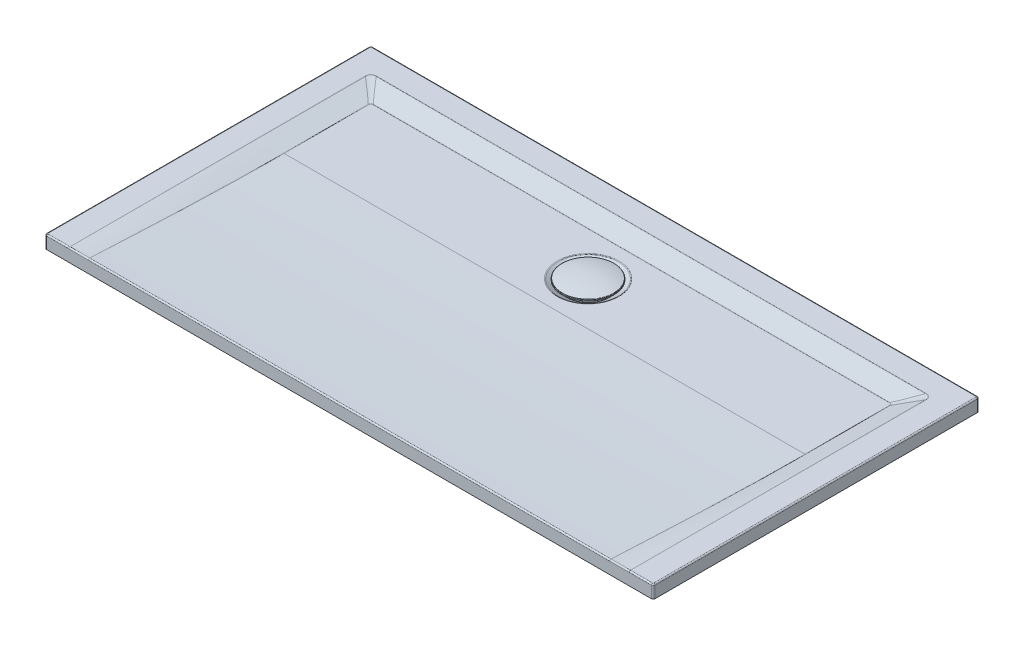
SolidWorks part; units mm, degrees
ref_plane "Płaszczyzna przednia" through (0, 0, 0) normal (0, 0, 1) x (1, 0, 0)
ref_plane "Płaszczyzna górna" through (0, 0, 0) normal (0, 1, 0) x (1, 0, 0)
ref_plane "Płaszczyzna prawa" through (0, 0, 0) normal (1, 0, 0) x (0, 0, -1)
sketch "Szkic1" plane through (0, 0, 0) normal (0, 1, 0) x (1, 0, 0)
  line L0 (0, 375) -> (0, -375) construction
  line L1 (-700, 375) -> (700, 375)
  line L2 (-700, 375) -> (-700, -375)
  line L3 (-700, -375) -> (700, -375)
  line L4 (700, 375) -> (700, -375)
  line L5 (-645, -375) -> (-645, 320)
  line L6 (-645, 320) -> (645, 320)
  line L7 (645, 320) -> (645, -375)
  line L8 (-600, -375) -> (-600, 275)
  line L9 (-600, 275) -> (600, 275)
  line L10 (600, 275) -> (600, -375)
  circle A0 centre (0, 175) radius 45
  circle A1 centre (0, 175) radius 70
  point P9 (0, 320)
  dimension "D6" = 90
  dimension "D7" = 140
  dimension "D1" = 1400
  dimension "D2" = 55
  dimension "D3" = 55
  dimension "D5" = 200
  dimension "D8" = 750
  dimension "D4" = 45
sketch "Szkic2" plane through (0, 0, 0) normal (0, 1, 0) x (1, 0, 0)
  line L0 (-700, -375) -> (700, -375) construction
  line L1 (700, 375) -> (700, -375) construction
  line L2 (645, 320) -> (645, -375) construction
  line L3 (-645, 320) -> (645, 320) construction
  line L4 (-700, 375) -> (700, 375) construction
  line L5 (-645, -375) -> (-645, 320) construction
  line L6 (-700, 375) -> (-700, -375) construction
  line L7 (-700, -375) -> (-645, -375)
  line L8 (700, 375) -> (700, -375)
  line L9 (645, 320) -> (645, -375)
  line L10 (-645, 320) -> (645, 320)
  line L11 (-700, 375) -> (700, 375)
  line L12 (-645, -375) -> (-645, 320)
  line L13 (-700, 375) -> (-700, -375)
  line L14 (645, -375) -> (700, -375)
surface "Powierzchnia-Płaszczyzna1" sketch "Szkic2"
ref_plane "Płaszczyzna1" through (0, -15, 0) normal (0, 1, 0) x (-1, 0, 0)
sketch "Szkic3" plane through (0, -15, 0) normal (0, 1, 0) x (-1, 0, 0)
  line L0 (600, -75) -> (-600, -75)
  line L1 (600, 375) -> (600, -275) construction
  line L2 (-600, -275) -> (-600, 375) construction
  line L3 (0, -75) -> (0, -275) construction
  line L4 (600, -275) -> (-600, -275) construction
  line L5 (-600, -275) -> (-600, -75)
  line L6 (600, -75) -> (600, -275)
  line L7 (600, -275) -> (-600, -275)
  circle A0 centre (0, -175) radius 70 construction
  circle A1 centre (0, -175) radius 70
  point P10 (0, -175)
surface "Powierzchnia-Płaszczyzna2" sketch "Szkic3"
sketch "Szkic4" plane through (0, 0, 0) normal (0, 1, 0) x (1, 0, 0)
  line L0 (600, -375) -> (-600, -375)
other "Granica-Powierzchnia1"
other "Granica-Powierzchnia2"
other "Granica-Powierzchnia3"
mirror "Lustro1" about plane through (0, 0, 0) normal (1, 0, 0)
sketch "Szkic5" plane through (0, 0, 0) normal (0, 1, 0) x (1, 0, 0)
  line L0 (700, 375) -> (700, -375) construction
  line L1 (-700, 375) -> (700, 375) construction
  line L2 (-700, 375) -> (-700, -375) construction
  line L3 (-700, -375) -> (700, -375) construction
  line L4 (700, 375) -> (700, -375)
  line L5 (-700, 375) -> (700, 375)
  line L6 (-700, 375) -> (-700, -375)
  line L7 (-700, -375) -> (700, -375)
surface "Powierzchnia-Wyciągnięcie1" sketch "Szkic5" parameters "D1"=30
sketch "Szkic7" plane through (0, 0, 0) normal (1, 0, 0) x (0, 0, -1)
  line L0 (175, 0) -> (175, -30) construction
  line L1 (375, -30) -> (-375, -30) construction
  line L2 (220, -30) -> (220, -28)
  line L3 (220, -28) -> (224, -28)
  line L6 (224, -28) -> (245, -15)
  dimension "D1" = 90
  dimension "D2" = 2
  dimension "D3" = 98
surface "Powierzchnia-Obrót wokół linii środkowej1" sketch "Szkic7" parameters "D1"=360
surface "Powierzchnia-Płaszczyzna3"
surface "Powierzchnia-Połącz1"
fillet "Zaokrąglenie1" radius 4 6 edges at (0, -28, -224) (0, -15, -105) (700, -15, 375) (700, -15, -375) (-700, -15, -375) (-700, -15, 375)
fillet "Zmienne zaokrąglenie1" radius 40 2 edges at (622.5, -7.5, -297.5)
fillet "Zaokrąglenie3" radius 3 12 edges
fillet "Zaokrąglenie4" radius 3 12 edges at (-698.8284, 0, -373.8284) (0, 0, -375) (698.8284, 0, -373.8284) (700, 0, 0) (698.8284, 0, 373.8284) (670.5, 0, 375) (-670.5, 0, 375) (-698.8284, 0, 373.8284) (-700, 0, 0)
sketch "Szkic8" plane through (0, 0, 0) normal (1, 0, 0) x (0, 0, -1)
  line L0 (175, 0) -> (175, -30) construction
  line L1 (175, -5.6601) -> (179.8469, -5.6601) construction
  line L2 (235, -14.7573) -> (235, -17)
  line L3 (235, -17) -> (175, -17)
  line L4 (175, -17) -> (175, -5.6601)
  line L5 (175, -5.6601) -> (199.9922, 95.6514)
  arc A0 (175, -5.6601) -> (234.2694, -13.7943) centre (175, -225.6601) cw
  arc A1 (234.2694, -13.7943) -> (235, -14.7573) centre (234, -14.7573) cw
  point P11 (235, -14)
  dimension "D1" = 220
  dimension "D4" = 1
  dimension "D2" = 60
  dimension "D3" = 3
  dimension "D5" = 13
revolve "Obrót wokół linii środkowej1" add sketch "Szkic8" angle 360 about L4
